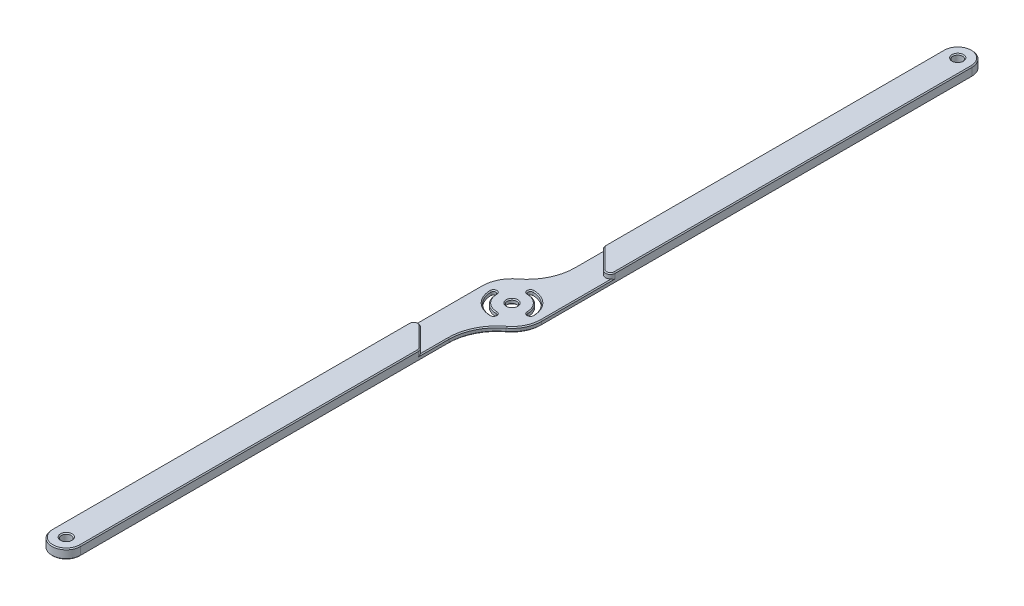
SolidWorks part; units mm, degrees
other "<完成支撑件>-<倒角6>"
ref_plane "前视基准面" through (0, 0, 0) normal (0, 0, 1) x (1, 0, 0)
ref_plane "上视基准面" through (0, 0, 0) normal (0, 1, 0) x (1, 0, 0)
ref_plane "右视基准面" through (0, 0, 0) normal (1, 0, 0) x (0, 0, -1)
mirrored part "完成支撑件_镜向"
